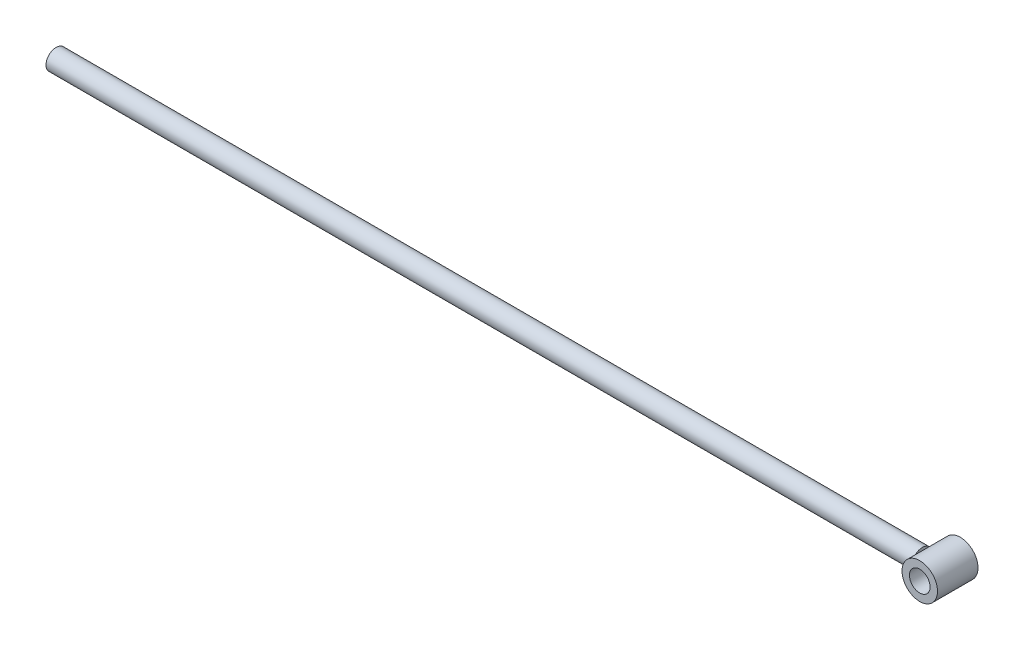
SolidWorks part; units mm, degrees
ref_plane "Plan de face" through (0, 0, 0) normal (0, 0, 1) x (1, 0, 0)
ref_plane "Plan de dessus" through (0, 0, 0) normal (0, 1, 0) x (1, 0, 0)
ref_plane "Plan de droite" through (0, 0, 0) normal (1, 0, 0) x (0, 0, -1)
sketch "Esquisse1" plane through (0, 0, 0) normal (1, 0, 0) x (0, 0, -1)
  circle A0 centre (0, 0) radius 10
  dimension "D1" = 20
extrude "Extrusion1" add sketch "Esquisse1" along normal blind 855
sketch "Esquisse2" plane through (0, 0, 0) normal (0, 0, 1) x (1, 0, 0)
  line L0 (855, -10) -> (855, 10) construction
  circle A0 centre (872.5, 0) radius 17.5
  circle A1 centre (872.5, 0) radius 10.2
  dimension "D1" = 20.4
  dimension "D2" = 35
extrude "Extrusion2" add sketch "Esquisse2" along normal mid plane 40
ref_plane "Plan1" through (842, 0, 0) normal (1, 0, 0) x (0, 0, -1)
